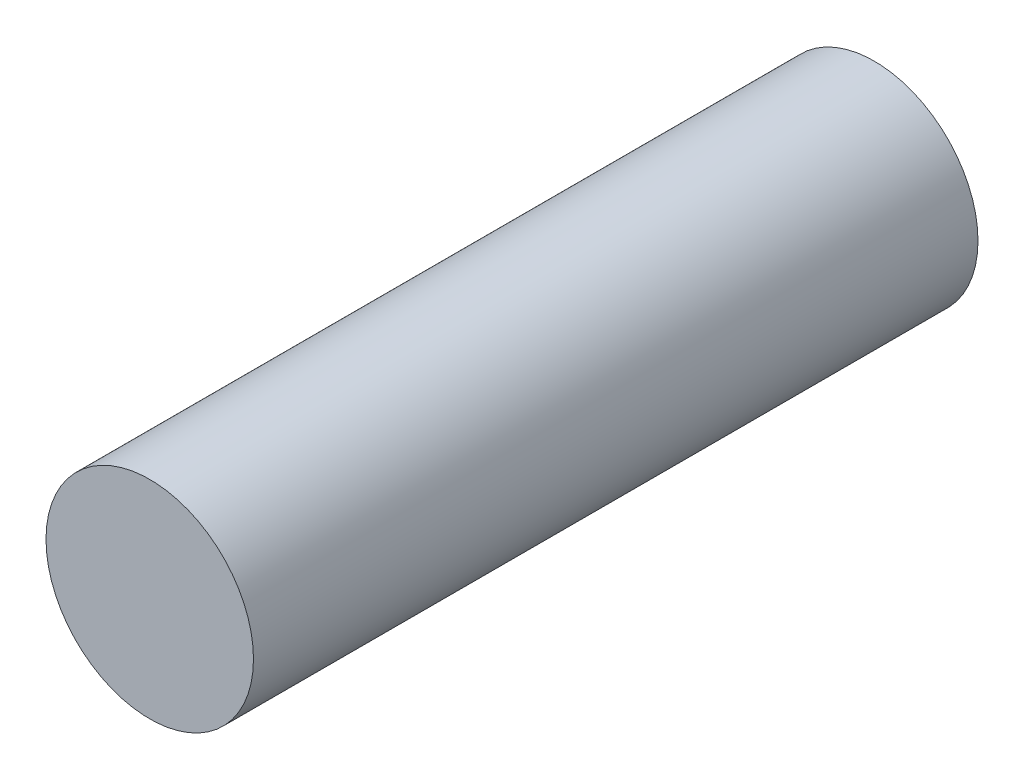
SolidWorks part; units mm, degrees
ref_plane "Front Plane" through (0, 0, 0) normal (0, 0, 1) x (1, 0, 0)
ref_plane "Top Plane" through (0, 0, 0) normal (0, 1, 0) x (1, 0, 0)
ref_plane "Right Plane" through (0, 0, 0) normal (1, 0, 0) x (0, 0, -1)
sketch "Sketch2" plane through (0, 0, 0) normal (0, 0, 1) x (1, 0, 0)
  circle A0 centre (0, 0) radius 4.0005
  dimension "D1" = 8.001
extrude "Boss-Extrude1" add sketch "Sketch2" along normal blind 27.94
